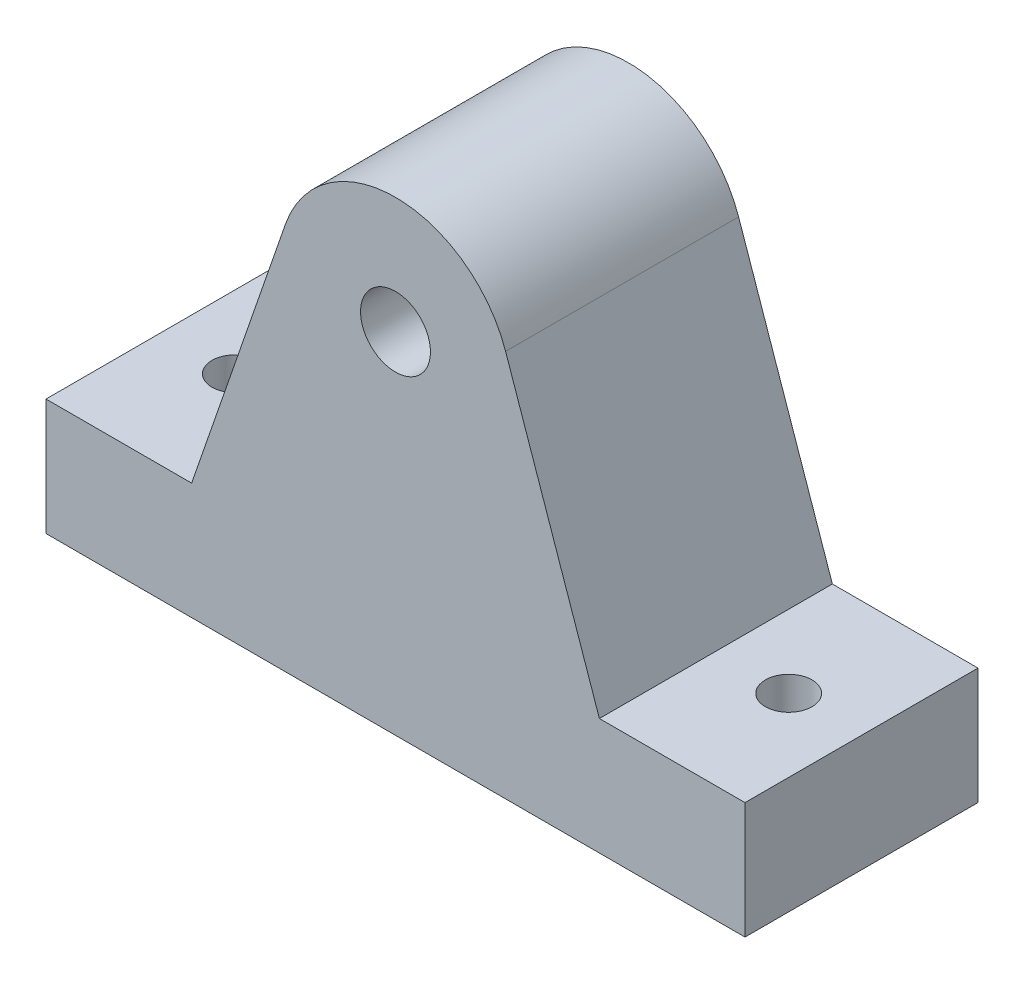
SolidWorks part; units mm, degrees
ref_plane "Front" through (0, 0, 0) normal (0, 0, 1) x (1, 0, 0)
ref_plane "Top" through (0, 0, 0) normal (0, 1, 0) x (1, 0, 0)
ref_plane "Right" through (0, 0, 0) normal (1, 0, 0) x (0, 0, -1)
sketch "Sketch1" plane through (0, 0, 0) normal (0, 0, 1) x (1, 0, 0)
  line L0 (-30, 0) -> (30, 0)
  line L1 (30, 0) -> (30, 10)
  line L2 (30, 10) -> (17.5, 10)
  line L3 (17.5, 10) -> (9.4505, 33.2692)
  line L4 (0, 77.8585) -> (0, -6.5567) construction
  line L5 (-30, 0) -> (-30, 10)
  line L6 (-30, 10) -> (-17.5, 10)
  line L7 (-17.5, 10) -> (-9.4505, 33.2692)
  arc A0 (9.4505, 33.2692) -> (-9.4505, 33.2692) centre (0, 30) ccw
  circle A1 centre (0, 30) radius 3
  point P10 (0, 0)
  point P13 (0, 0)
  dimension "D2" = 6
  dimension "D3" = 10
  dimension "D1" = 30
  dimension "D4" = 10
  dimension "D5" = 12.5
  dimension "D6" = 30
extrude "Boss-Extrude1" add sketch "Sketch1" along normal blind 20 contours L3 A0 L7 L6 L5 L0 L1 L2
sketch "Sketch2" plane through (0, 10, 0) normal (0, 1, 0) x (1, 0, 0)
  line L2 (-23.75, -16.1965) -> (-23.75, -4.2258) construction
  line L3 (-17.5, -20) -> (-17.5, 0) construction
  line L4 (-30, -20) -> (-30, 0) construction
  line L5 (-19.0812, -10) -> (-27.627, -10) construction
  line L6 (-17.5, 0) -> (-30, 0) construction
  line L7 (-17.5, -20) -> (-30, -20) construction
  line L8 (0, 18.606) -> (0, -32.7359) construction
  circle A0 centre (-23.75, -10) radius 2
  circle A1 centre (23.75, -10) radius 2
  dimension "D1" = 4
extrude "Cut-Extrude1" cut sketch "Sketch2" against normal through all
